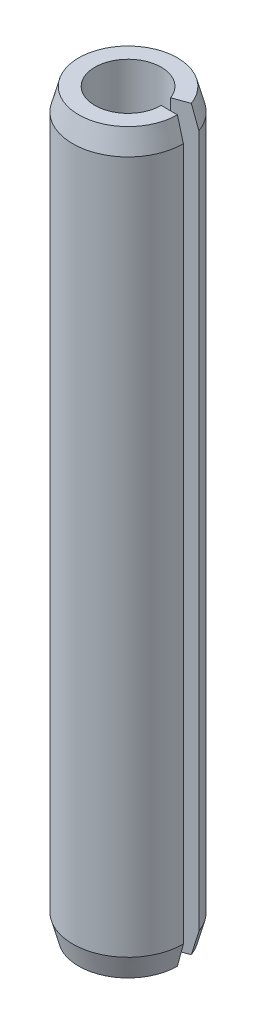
SolidWorks part; units mm, degrees
ref_plane "Face" through (0, 0, 0) normal (0, 0, 1) x (1, 0, 0)
ref_plane "Dessus" through (0, 0, 0) normal (0, 1, 0) x (1, 0, 0)
ref_plane "Cote" through (0, 0, 0) normal (1, 0, 0) x (0, 0, -1)
sketch "Esquisse3" plane through (0, 0, 0) normal (0, 0, 1) x (1, 0, 0)
  line L1 (1.5, 0.6) -> (1.3392, 0)
  line L2 (1.5, 19.4) -> (1.3392, 20)
  line L3 (1.5, 19.4) -> (1.5, 0.6)
  line L4 (0, 20) -> (0, 0) construction
  line L5 (0.9, 20) -> (1.3392, 20)
  line L6 (0.9, 20) -> (0.9, 0)
  line L7 (1.3392, 0) -> (0.9, 0)
  dimension "D1" = 15
  dimension "D2" = 0.6
  dimension "D" = 3
  dimension "L" = 20
  dimension "A" = 0.6
revolve "Base-Révolution" add sketch "Esquisse3" angle 340 about L4
equation "\"D2@Esquisse3\" = \"A@Esquisse3\""
